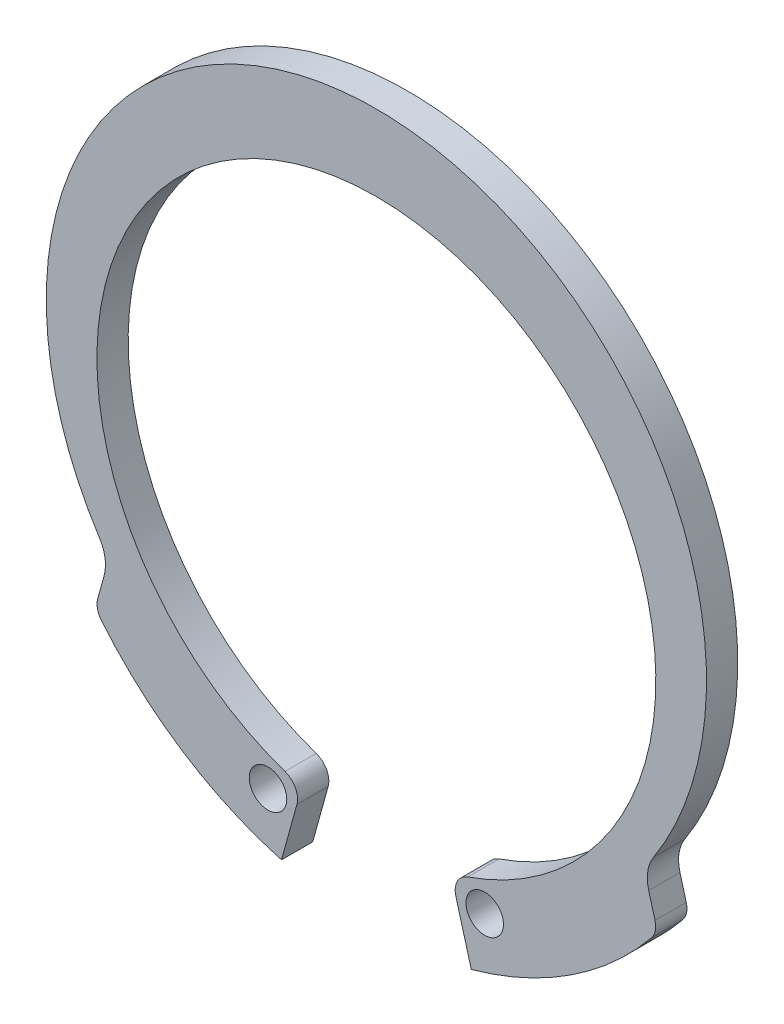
SolidWorks part; units mm, degrees
ref_plane "Plane1" through (0, 0, 0) normal (0, 0, 1) x (1, 0, 0)
ref_plane "Plane2" through (0, 0, 0) normal (0, 1, 0) x (1, 0, 0)
ref_plane "Plane3" through (0, 0, 0) normal (1, 0, 0) x (0, 0, -1)
sketch "Clipboard" plane through (0, 0, 0) normal (0, 0, 1) x (1, 0, 0)
  line L0 (0, 0) -> (1.7272, 0)
  line L1 (0, 0) -> (0, 1.0668)
  line L2 (0, 0) -> (0, -2.159)
  circle A0 centre (0, 0) radius 0.5334
  circle A1 centre (0, 0) radius 9.525
  dimension "HoleDia" = 1.0668
  dimension "BoreDia" = 19.05
  dimension "SmallSection" = 1.0668
  dimension "LugSection" = 2.159
sketch "BodySke" plane through (0, 0, 0) normal (0, 0, 1) x (1, 0, 0)
  line L0 (0, 0) -> (0, 11.176) construction
  line L1 (0, 0) -> (10.8692, 0) construction
  line L2 (0, 0) -> (-7.3499, -4.1601) construction
  line L3 (0, 0) -> (8.7977, -4.9796) construction
  line L4 (-2.2612, -8.1593) -> (-2.6999, -9.742)
  line L5 (2.2612, -8.1593) -> (2.6999, -9.742)
  line L6 (7.7473, -5.2707) -> (7.927, -5.9192)
  line L7 (-7.7473, -5.2707) -> (-7.927, -5.9192)
  line L8 (-2.8716, -7.4135) -> (-3.4505, -9.5021) construction
  line L9 (2.8716, -7.4135) -> (3.4505, -9.5021) construction
  arc A0 (2.6999, -9.742) -> (7.8259, -6.3993) centre (0, 0) ccw
  arc A1 (-7.6041, -4.3039) -> (7.6041, -4.3039) centre (0, 0) ccw construction
  arc A2 (2.6008, -7.5128) -> (-2.6008, -7.5128) centre (0, 0) ccw
  arc A3 (-7.7473, -5.2707) -> (-7.8828, -4.387) centre (-8.7977, -4.9796) ccw
  arc A4 (7.8828, -4.387) -> (7.7473, -5.2707) centre (8.7977, -4.9796) ccw
  arc A5 (-7.8259, -6.3993) -> (-2.6999, -9.742) centre (0, 0) ccw
  arc A6 (7.8472, -4.4416) -> (-7.8472, -4.4416) centre (0, 0.7178) ccw construction
  arc A7 (7.8828, -4.387) -> (-7.8828, -4.387) centre (0, 0.7178) ccw
  circle A8 centre (0, 0) radius 10.1092 construction
  circle A9 centre (3.0828, -8.1757) radius 0.5334
  circle A10 centre (-3.0828, -8.1757) radius 0.5334
  arc A11 (-7.8259, -6.3993) -> (-7.927, -5.9192) centre (-7.413, -6.0616) cw
  arc A12 (-2.2612, -8.1593) -> (-2.6008, -7.5128) centre (-2.7753, -8.0168) ccw
  arc A13 (2.2612, -8.1593) -> (2.6008, -7.5128) centre (2.7753, -8.0168) cw
  arc A14 (7.8259, -6.3993) -> (7.927, -5.9192) centre (7.413, -6.0616) ccw
  dimension "GrooveDia" = 20.2184
  dimension "HoleOffsetRad" = 8.7376
  dimension "HoleDia" = 1.0668
  dimension "InsideDia" = 15.9004
  dimension "SmallRad" = 9.017
  dimension "GapAngle" = 30.98
  dimension "LugAngle" = 120.98
  dimension "HoleOffset" = 0.7874
extrude "Body" add sketch "BodySke" against normal blind 0.889
equation "' \"BoreDia@Clipboard\" = 0.625"
equation "' \"Thickness@Body\" = 0.025"
equation "' \"GrooveDia@BodySke\" = 0.665"
equation "' \"LugSection@Clipboard\" = 0.072"
equation "' \"SmallSection@Clipboard\" = 0.036"
equation "' \"HoleDia@Clipboard\" = 0.03"
equation "' \"BoreDia@Clipboard\" = 0.75"
equation "' \"Thickness@Body\" = 0.035"
equation "' \"GrooveDia@BodySke\" = 0.796"
equation "' \"LugSection@Clipboard\" = 0.085"
equation "' \"SmallSection@Clipboard\" = 0.042"
equation "' \"HoleDia@Clipboard\" = 0.042"
equation "\"InsideDia@BodySke\" = \"GrooveDia@BodySke\" -  \"LugSection@Clipboard\" * 2"
equation "\"GapAngle@BodySke\" = 360 - 360 * 0.97 * ( \"BoreDia@Clipboard\" / \"GrooveDia@BodySke\" )"
equation "\"LugAngle@BodySke\" = \"GapAngle@BodySke\" + 90"
equation "\"SmallRad@BodySke\" =  \"InsideDia@BodySke\" / 2 +  \"SmallSection@Clipboard\""
equation "\"HoleOffsetRad@BodySke\" = (  \"BoreDia@Clipboard\" + \"InsideDia@BodySke\" ) / 4"
equation "\"HoleOffset@BodySke\" = \"HoleOffsetRad@BodySke\" - \"InsideDia@BodySke\" / 2"
equation "\"HoleDia@BodySke\" =  \"HoleDia@Clipboard\""
